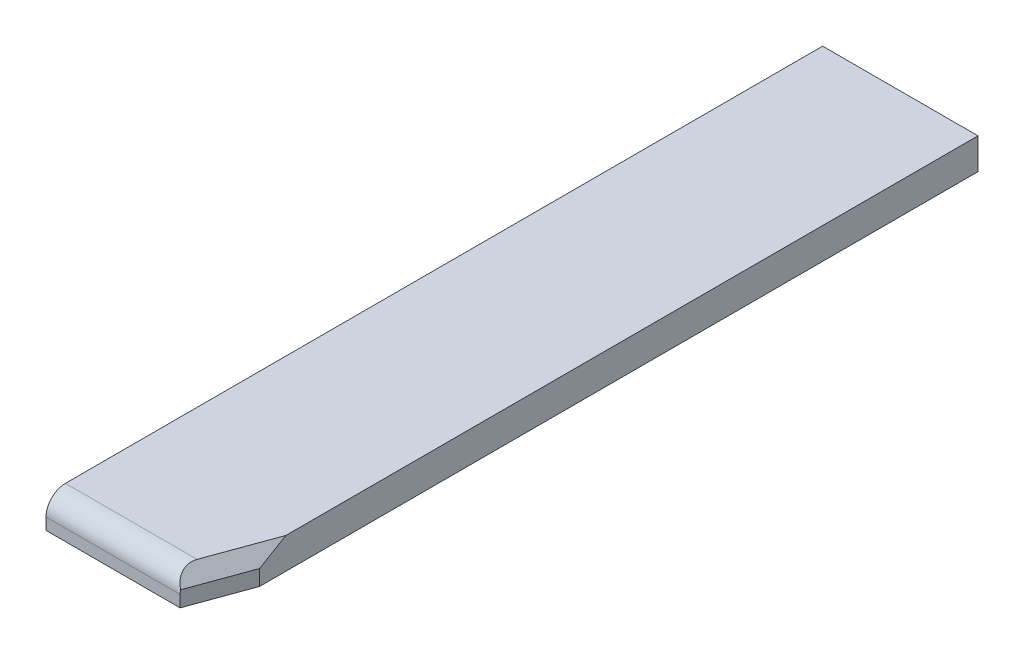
SolidWorks part; units mm, degrees
ref_plane "Plan de face" through (0, 0, 0) normal (0, 0, 1) x (1, 0, 0)
ref_plane "Plan de dessus" through (0, 0, 0) normal (0, 1, 0) x (1, 0, 0)
ref_plane "Plan de droite" through (0, 0, 0) normal (1, 0, 0) x (0, 0, -1)
sketch "Esquisse1" plane through (0, 0, 0) normal (0, 0, 1) x (1, 0, 0)
  line L1 (-20, 0) -> (20, 0)
  line L2 (-20, 0) -> (-20, 8)
  line L3 (-20, 8) -> (20, 8)
  line L4 (20, 0) -> (20, 8)
  dimension "D1" = 8
  dimension "D2" = 40
extrude "Extrusion1" add sketch "Esquisse1" against normal blind 200
chamfer "Chanfrein1" distance 15 angle 20 1 edges at (20, 4, 0)
chamfer "Chanfrein2" distance 4 angle 30 1 edges at (17.2702, 8, -7.5)
ref_plane "Plan1" through (0, 0, -70) normal (0, 0, 1) x (1, 0, 0)
sketch "Esquisse3" plane through (-20, 0, 0) normal (-1, 0, 0) x (0, 0, 1)
  line L0 (-200, 8) -> (0, 8) construction
  line L1 (0, 8) -> (0, 0) construction
  line L2 (-5, 8) -> (0, 8)
  line L3 (0, 8) -> (0, 3)
  arc A0 (0, 3) -> (-5, 8) centre (-5, 3) ccw
  dimension "D1" = 10
extrude "Enlèv. mat.-Extru.2" cut sketch "Esquisse3" against normal up to next
